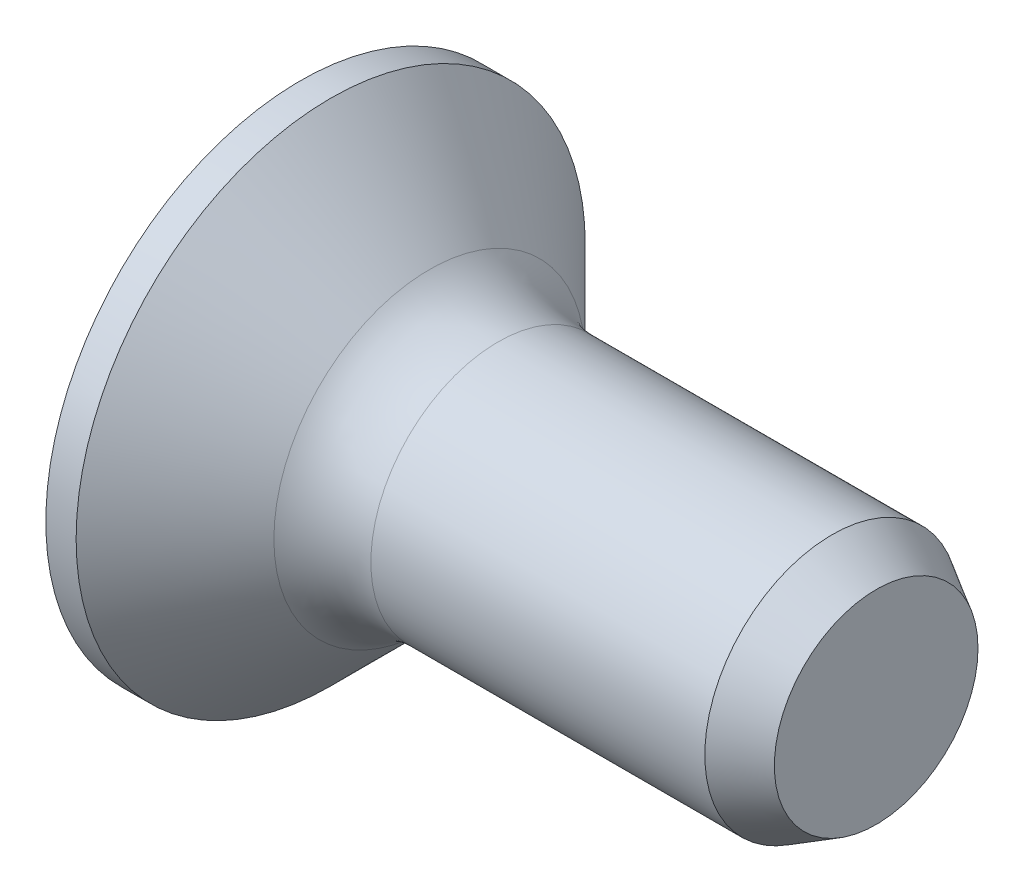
SolidWorks part; units mm, degrees
ref_plane "Front" through (0, 0, 0) normal (0, 0, 1) x (1, 0, 0)
ref_plane "Top" through (0, 0, 0) normal (0, 1, 0) x (1, 0, 0)
ref_plane "Right" through (0, 0, 0) normal (1, 0, 0) x (0, 0, -1)
sketch "Sketch1" plane through (0, 0, 0) normal (0, 0, 1) x (1, 0, 0)
  line L0 (0, 4.2) -> (0.5, 4.2)
  line L1 (0.5, 4.2) -> (2.6, 2.1)
  line L2 (2.6, 2.1) -> (9.5, 2.1)
  line L3 (9.5, 2.1) -> (9.5, 0)
  line L4 (9.5, 0) -> (0, 0)
  line L5 (0, 0) -> (0, 4.2)
  line L6 (6.6207, 0) -> (-0.9387, 0) construction
  dimension "D1" = 45
  dimension "d" = 4.2
  dimension "dK" = 8.4
  dimension "k" = 2.6
  dimension "l" = 9.5
revolve "Revolve1" add sketch "Sketch1" angle 360 about L6
chamfer "Chamfer1" distance 0.42 angle 60 1 edges at (9.5, 0, -2.1)
sketch "Sketch9" plane through (0, 0, 0) normal (0, 0, 1) x (1, 0, 0)
  line L0 (3.8513, 1.6) -> (3.0287, 1.6)
  line L1 (3.0287, 1.6) -> (2.74, 2.1)
  line L2 (3.8513, 1.6) -> (4.14, 2.1)
  line L3 (2.74, 2.1) -> (2.74, 2.35)
  line L4 (4.14, 2.1) -> (4.14, 2.35)
  line L5 (2.74, 2.35) -> (4.14, 2.35)
  line L6 (3.44, 1.6) -> (3.44, 0) construction
  line L7 (0, 0) -> (7.3035, 0) construction
  line L8 (2.6, 2.1) -> (2.6, -2.1) construction
  line L9 (8.7725, 2.1) -> (2.6, 2.1) construction
  dimension "D2" = 60
  dimension "D3" = 0.25
  dimension "threadstart" = 0.84
  dimension "minordia" = 3.2
  dimension "advance" = 1.4
revolve "ThreadSchematic" [suppressed] cut sketch "Sketch9" angle 360 about L7
pattern_linear "ThdSchPat" [suppressed] count 5 spacing 1.4 along (-1, 0, 0)
sketch "Sketch3" plane through (0, 0, 0) normal (0, 0, 1) x (1, 0, 0)
  line L0 (2.6, 2.1) -> (9.5, 2.1) construction
  line L2 (5.8, 2.1) -> (6.725, 2.1) construction
  line L3 (9.5, 2.1) -> (9.5, 0) construction
  line L4 (6.725, 2.1) -> (9.5, 2.1)
  line L5 (2.9, 0) -> (5.4301, 0) construction
  line L6 (9.5, 0) -> (9.7, 0)
  line L7 (9.7, 0) -> (9.7, 2.1)
  line L8 (9.7, 2.1) -> (9.5, 2.1)
  line L9 (6.725, 2.1) -> (9.5, 0)
  dimension "D1" = 0.925
  dimension "y" = 3.7
  dimension "D2" = 0.2
revolve "EndCone" [suppressed] cut sketch "Sketch3" angle 360 about L5
sketch "Sketch4" plane through (0, 0, 0) normal (-1, 0, 0) x (0, 0, 1)
  line L0 (-0.575, 2.3) -> (-0.575, 0.575)
  line L1 (-0.575, 2.3) -> (0.575, 2.3)
  line L2 (-2.3, 0.575) -> (-2.3, -0.575)
  line L3 (-0.575, -2.3) -> (0.575, -2.3)
  line L4 (2.3, 0.575) -> (2.3, -0.575)
  line L5 (0.575, 2.3) -> (0.575, 0.575)
  line L6 (0.575, 0.575) -> (2.3, 0.575)
  line L7 (0.575, -0.575) -> (2.3, -0.575)
  line L8 (0.575, -0.575) -> (0.575, -2.3)
  line L9 (-0.575, -0.575) -> (-0.575, -2.3)
  line L10 (-0.575, -0.575) -> (-2.3, -0.575)
  line L11 (-0.575, 0.575) -> (-2.3, 0.575)
  line L12 (2.3, 0) -> (-2.3, 0) construction
  dimension "D1" = 1.15
  dimension "m" = 4.6
extrude "Cut-Extrude1" cut sketch "Sketch4" against normal blind 2.1
draft "Draft1" type of draft neutral plane draft angle 35 faces to draft 4 parameters "D1"=35
draft "Draft2" type of draft neutral plane draft angle 8 faces to draft 8 parameters "D1"=8
sketch "Sketch6" plane through (2.1, 0, 0) normal (-1, 0, 0) x (0, 0, 1)
  line L0 (0.2799, 0.2799) -> (0.2799, 0.8296) construction
  line L1 (0.8296, 0.2799) -> (0.2799, 0.2799) construction
  line L2 (-0.2799, 0.8296) -> (-0.2799, 0.2799) construction
  line L3 (-0.2799, 0.2799) -> (-0.8296, 0.2799) construction
  line L4 (-0.8296, -0.2799) -> (-0.2799, -0.2799) construction
  line L5 (-0.2799, -0.2799) -> (-0.2799, -0.8296) construction
  line L6 (0.2799, -0.8296) -> (0.2799, -0.2799) construction
  line L7 (0.2799, -0.2799) -> (0.8296, -0.2799) construction
  line L9 (-0.5547, 0.2799) -> (-0.5547, -0.2799)
  line L10 (-0.2799, -0.5547) -> (0.2799, -0.5547)
  line L11 (0.5547, -0.2799) -> (0.5547, 0.2799)
  line L12 (0.2799, 0.5547) -> (-0.2799, 0.5547)
  arc A0 (0.2799, 0.5547) -> (0.5547, 0.2799) centre (0.5547, 0.5547) ccw
  arc A1 (-0.2799, 0.5547) -> (-0.5547, 0.2799) centre (-0.5547, 0.5547) cw
  arc A2 (-0.5547, -0.2799) -> (-0.2799, -0.5547) centre (-0.5547, -0.5547) cw
  arc A3 (0.2799, -0.5547) -> (0.5547, -0.2799) centre (0.5547, -0.5547) cw
sketch "Sketch7" plane through (0, 0, 0) normal (-1, 0, 0) x (0, 0, 1)
  line L8 (0.575, 0.575) -> (0.575, 2.3) construction
  line L9 (2.3, 0.575) -> (0.575, 0.575) construction
  line L10 (0.575, -0.575) -> (2.3, -0.575) construction
  line L11 (0.575, -2.3) -> (0.575, -0.575) construction
  line L12 (-0.575, 2.3) -> (-0.575, 0.575) construction
  line L13 (-0.575, 0.575) -> (-2.3, 0.575) construction
  line L14 (-2.3, -0.575) -> (-0.575, -0.575) construction
  line L15 (-0.575, -0.575) -> (-0.575, -2.3) construction
  line L16 (0.8498, 0.575) -> (0.8498, -0.575)
  line L17 (0.575, -0.8498) -> (-0.575, -0.8498)
  line L18 (-0.8498, -0.575) -> (-0.8498, 0.575)
  line L19 (-0.575, 0.8498) -> (0.575, 0.8498)
  arc A0 (0.575, 0.8498) -> (0.8498, 0.575) centre (0.8498, 0.8498) ccw
  arc A1 (-0.575, 0.8498) -> (-0.8498, 0.575) centre (-0.8498, 0.8498) cw
  arc A2 (-0.8498, -0.575) -> (-0.575, -0.8498) centre (-0.8498, -0.8498) cw
  arc A3 (0.2799, 0.5547) -> (0.5547, 0.2799) centre (0.5547, 0.5547) ccw construction
  arc A4 (0.8498, -0.575) -> (0.575, -0.8498) centre (0.8498, -0.8498) ccw
loft "Cut-Loft1" cut profiles "Sketch6", "Sketch7"
sketch "Sketch8" plane through (0, 0, 0) normal (-1, 0, 0) x (0, 0, 1)
  line L0 (0, 0) -> (2.3, 2.3) construction
  line L1 (0.2799, 0.5547) -> (2.3, 2.3)
  line L2 (2.3, 2.3) -> (0.5547, 0.2799)
  line L3 (0.575, 2.3) -> (2.3, 2.3) construction
  line L4 (2.3, 2.3) -> (2.3, 0.575) construction
  line L5 (0, 0) -> (0.5547, 0) construction
  line L6 (0.5547, 0.2799) -> (0.5547, 0)
  line L7 (0.2799, 0.5547) -> (0, 0.5547)
  line L8 (0, 0.5547) -> (0, 0) construction
  line L9 (0.2799, -0.5547) -> (0, -0.5547)
  line L10 (2.3, -2.3) -> (0.2799, -0.5547)
  line L11 (0.5547, -0.2799) -> (2.3, -2.3)
  line L12 (0.5547, -0.2799) -> (0.5547, 0)
  line L13 (-0.5547, -0.2799) -> (-0.5547, 0)
  line L14 (-2.3, -2.3) -> (-0.5547, -0.2799)
  line L15 (-0.2799, -0.5547) -> (-2.3, -2.3)
  line L16 (-0.2799, -0.5547) -> (0, -0.5547)
  line L17 (-0.2799, 0.5547) -> (0, 0.5547)
  line L18 (-2.3, 2.3) -> (-0.2799, 0.5547)
  line L19 (-0.5547, 0.2799) -> (-2.3, 2.3)
  line L20 (-0.5547, 0.2799) -> (-0.5547, 0)
  arc A1 (0.2799, 0.5547) -> (0.5547, 0.2799) centre (0.5547, 0.5547) ccw construction
  arc A2 (0.2799, 0.5547) -> (0.5547, 0.2799) centre (0.5547, 0.5547) ccw construction
extrude "TypeZ" [suppressed] cut sketch "Sketch8" against normal blind 0.42 draft 3
fillet "Fillet1" radius 1.6 1 edges at (2.6, 0, -2.1)
equation "\"D1@Chamfer1\" = \"d@Sketch1\" / 10"
equation "\"D1@Sketch4\" = \"m@Sketch4\" / 4"
equation "\"D1@TypeZ\" = \"p@Cut-Extrude1\"*0.2"
equation "\"D1@Sketch3\" = \"y@Sketch3\" / 4"
equation "\"threadstart@Sketch9\"=\"advance@Sketch9\"*0.6"
equation "\"D1@ThdSchPat\" = int(((\"l@Sketch1\"-\"k@Sketch1\")/\"advance@Sketch9\") + 0.8)"
equation "\"D3@ThdSchPat\" = \"advance@Sketch9\""
equation "\"minordia@sketch9\" = \"d2@threadcosmetic\""
